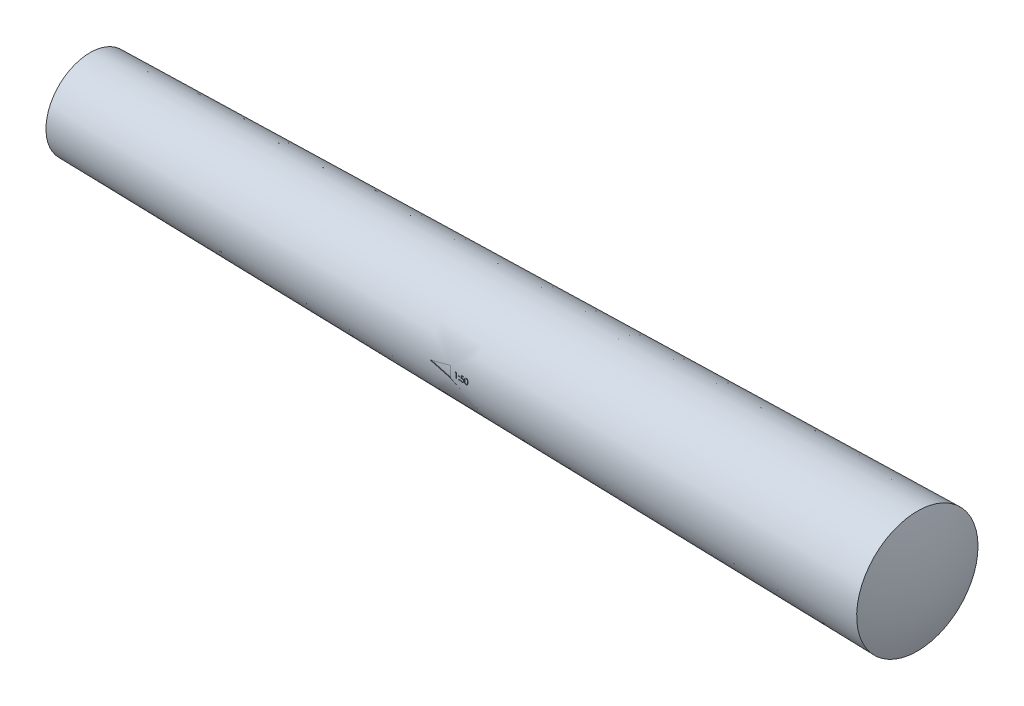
SolidWorks part; units mm, degrees
ref_plane "Front Plane" through (0, 0, 0) normal (0, 0, 1) x (1, 0, 0)
ref_plane "Top Plane" through (0, 0, 0) normal (0, 1, 0) x (1, 0, 0)
ref_plane "Right Plane" through (0, 0, 0) normal (1, 0, 0) x (0, 0, -1)
sketch "Sketch1" plane through (0, 0, 0) normal (1, 0, 0) x (0, 0, -1)
  circle A0 centre (0, 0) radius 8
  dimension "D1" = 16
extrude "Extrude1" add sketch "Sketch1" along normal mid plane 150
draft "Draft1" type of draft neutral plane draft angle 1.146 faces to draft 1 parameters "D1"=1.146
sketch "Sketch2" plane through (0, 0, 0) normal (0, 0, 1) x (1, 0, 0)
  line L0 (-75, 0) -> (-75, 8)
  line L1 (-75, 8) -> (-75, -8) construction
  line L2 (-75, 0) -> (-77, 0)
  line L3 (-77, 0) -> (-77, -9.5) construction
  line L4 (75, 0) -> (75, 11.0001)
  line L5 (75, -11.0001) -> (75, 11.0001) construction
  line L6 (75, 0) -> (77, 0)
  line L7 (77, 0) -> (77, -9.5) construction
  line L8 (-75, -8) -> (75, -11.0001) construction
  arc A0 (-77, 0) -> (-75, 8) centre (-60, 0) cw
  arc A1 (77, 0) -> (75, 11.0001) centre (45.7495, 0) ccw
  point P14 (0, -9.5)
revolve "Revolve1" add sketch "Sketch2" angle 360 about L2
sketch "Sketch5" plane through (0, 0, 0) normal (0, 0, 1) x (1, 0, 0)
  line L0 (0, 9.5) -> (0, -9.5) construction
  line L1 (75, 11.0001) -> (-75, 8) construction
  line L2 (-75, -8) -> (75, -11.0001) construction
ref_plane "Plane2" through (0, 0, 0) normal (-0.02, 0, 0.9998) x (0.9998, 0, 0.02)
sketch "Sketch6" plane through (0, 0, 0) normal (-0.02, 0, 0.9998) x (0.9998, 0, 0.02)
  line L0 (0, 0) -> (0, 1)
  line L1 (0, 9.5) -> (0, -9.5) construction
  line L2 (0, 1) -> (-3.7321, 0)
  line L3 (-3.7321, 0) -> (0, -1)
  line L4 (0, -1) -> (0, 0)
  line L5 (0, -0.5) -> (4, -0.5) construction
  text T0 "1:50" font "Century Gothic" height 1
  dimension "D1" = 2
  dimension "D2" = 30
  dimension "D3" = 4
wrap "Wrap2" sketch "Sketch6" wrap type deboss source sketch "Sketch6" thickness 0.1 parameters "D1"=0.1
equation "\"D2@Sketch2\" = \"D1@Sketch2\""
